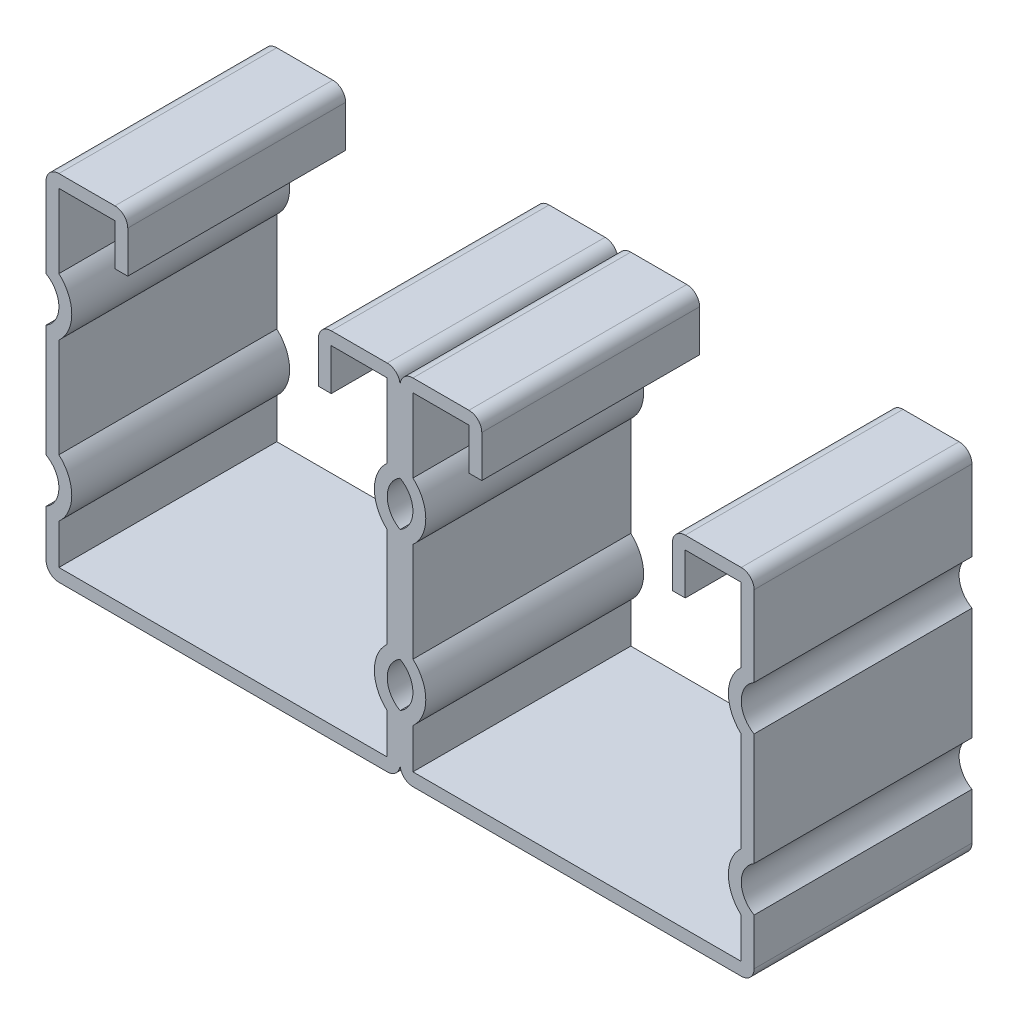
SolidWorks part; units mm, degrees
ref_plane "Plane1" through (0, 0, 0) normal (0, 0, 1) x (1, 0, 0)
ref_plane "Plane2" through (0, 0, 0) normal (0, 1, 0) x (1, 0, 0)
ref_plane "Plane3" through (0, 0, 0) normal (1, 0, 0) x (0, 0, -1)
sketch "Sketch1" plane through (0, 0, 0) normal (0, 0, 1) x (1, 0, 0)
  line L0 (-20.6375, 21.1074) -> (-20.6375, 11.7397)
  line L1 (-20.6375, 6.5483) -> (-20.6375, -6.5483)
  line L2 (-19.1389, -18.669) -> (19.1389, -18.669)
  line L3 (20.6375, -17.1704) -> (20.6375, -11.7397)
  line L4 (20.6375, 11.7397) -> (20.6375, 21.1074)
  line L5 (19.1389, 22.606) -> (12.6111, 22.606)
  line L6 (11.1125, 21.1074) -> (11.1125, 16.256)
  line L7 (-19.1389, 22.606) -> (-12.6111, 22.606)
  line L8 (-11.1125, 21.1074) -> (-11.1125, 16.256)
  line L9 (19.1389, -12.495) -> (19.1389, 12.495) construction
  line L10 (-19.1389, 12.495) -> (-19.1389, -12.495) construction
  line L11 (-12.6111, 21.1074) -> (-12.6111, 16.256)
  line L12 (-19.1389, 21.1074) -> (-12.6111, 21.1074)
  line L13 (-19.1389, 21.1074) -> (-19.1389, 12.495)
  line L14 (-19.1389, 5.793) -> (-19.1389, -5.793)
  line L15 (-19.1389, -17.1704) -> (19.1389, -17.1704)
  line L16 (19.1389, -17.1704) -> (19.1389, -12.495)
  line L17 (19.1389, 12.495) -> (19.1389, 21.1074)
  line L18 (19.1389, 21.1074) -> (12.6111, 21.1074)
  line L19 (12.6111, 21.1074) -> (12.6111, 16.256)
  line L20 (-12.6111, 16.256) -> (-11.1125, 16.256)
  line L21 (11.1125, 16.256) -> (12.6111, 16.256)
  line L22 (-10.16, 0) -> (12.7, 0) construction
  line L23 (-20.6375, -11.7397) -> (-20.6375, -17.1704)
  line L24 (-19.1389, -12.495) -> (-19.1389, -17.1704)
  line L25 (20.6375, -6.5483) -> (20.6375, 6.5483)
  line L26 (19.1389, -5.793) -> (19.1389, 5.793)
  arc A0 (20.6375, 11.7397) -> (20.6375, 6.5483) centre (22.1361, 9.144) ccw
  arc A1 (-20.6375, 6.5483) -> (-20.6375, 11.7397) centre (-22.1361, 9.144) ccw
  arc A2 (-12.6111, 22.606) -> (-11.1125, 21.1074) centre (-12.6111, 21.1074) cw
  arc A3 (-20.6375, 21.1074) -> (-19.1389, 22.606) centre (-19.1389, 21.1074) cw
  arc A4 (-19.1389, -18.669) -> (-20.6375, -17.1704) centre (-19.1389, -17.1704) cw
  arc A5 (20.6375, -17.1704) -> (19.1389, -18.669) centre (19.1389, -17.1704) cw
  arc A6 (19.1389, 22.606) -> (20.6375, 21.1074) centre (19.1389, 21.1074) cw
  arc A7 (11.1125, 21.1074) -> (12.6111, 22.606) centre (12.6111, 21.1074) cw
  arc A8 (-19.1389, 5.793) -> (-19.1389, 12.495) centre (-22.1361, 9.144) ccw
  arc A9 (19.1389, 12.495) -> (19.1389, 5.793) centre (22.1361, 9.144) ccw
  arc A10 (20.6375, -11.7397) -> (20.6375, -6.5483) centre (22.1361, -9.144) cw
  arc A11 (19.1389, -12.495) -> (19.1389, -5.793) centre (22.1361, -9.144) cw
  arc A12 (-19.1389, -5.793) -> (-19.1389, -12.495) centre (-22.1361, -9.144) cw
  arc A13 (-20.6375, -6.5483) -> (-20.6375, -11.7397) centre (-22.1361, -9.144) cw
  dimension "D1" = 20.6375
  dimension "D9" = 2.9972
  dimension "D10" = 2.9972
  dimension "D2" = 9.525
  dimension "Width" = 41.275
  dimension "base" = 18.669
  dimension "ToeHt" = 22.606
  dimension "D6" = 22.225
  dimension "edge" = 9.525
  dimension "Lip" = 6.35
  dimension "gauge" = 1.4986
extrude "Base-Extrude" add sketch "Sketch1" along normal mid plane 25.4
pattern_linear "LPattern1" count 2 spacing 41.275 along (1, 0, 0) of "Base-Extrude"
equation "\"D1@Sketch1\" = \"Width@Sketch1\" / 2"
equation "\"D6@Sketch1\" = \"Width@Sketch1\" - 2 * \"edge@Sketch1\""
equation "\"D10@Sketch1\" = 2 * \"gauge@Sketch1\""
equation "\"D9@Sketch1\" = \"D10@Sketch1\""
equation "\"D2@Sketch1\" = \"edge@Sketch1\""
